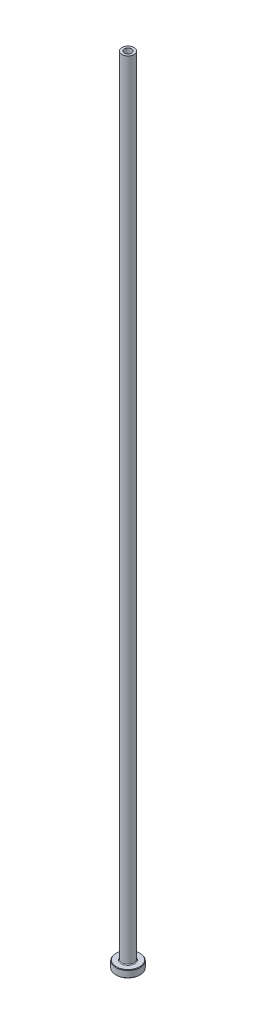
SolidWorks part; units mm, degrees
ref_plane "Front Plane" through (0, 0, 0) normal (0, 0, 1) x (1, 0, 0)
ref_plane "Top Plane" through (0, 0, 0) normal (0, 1, 0) x (1, 0, 0)
ref_plane "Right Plane" through (0, 0, 0) normal (1, 0, 0) x (0, 0, -1)
sketch "Sketch1" plane through (0, 0, 0) normal (0, 0, 1) x (1, 0, 0)
  line L0 (-1.5, 325) -> (-2.5, 325)
  line L1 (-2.5, 325) -> (-2.5, 3)
  line L2 (-2.5, 3) -> (-5, 3)
  line L3 (-5, 3) -> (-5, 0)
  line L4 (5.5, 0) -> (-5.5, 0) construction
  line L5 (-5, 0) -> (-1.75, 0)
  line L6 (-1.5, 280) -> (-1.5, 325)
  line L7 (0, 92.1877) -> (0, -15.5353) construction
  line L8 (0, -5.5) -> (0, 5.5) construction
  line L9 (-1.5, 280) -> (-1.75, 268)
  line L10 (-1.75, 268) -> (-1.75, 0)
  dimension "D1" = 0.25
  dimension "ID" = 3
  dimension "OD" = 5
  dimension "L" = 325
  dimension "H" = 10
  dimension "T" = 3
  dimension "N" = 45
  dimension "D2" = 12
revolve "Revolve1" add sketch "Sketch1" angle 360 about L7
fillet "Fillet1" radius 0.3 1 edges at (0, 3, 2.5)
chamfer "Chamfer1" distance 0.2 angle 45 2 edges at (0, 3, 5) (0, 0, 5)
chamfer "Chamfer3" distance 0.5 angle 45 1 edges at (0, 0, 1.75)
